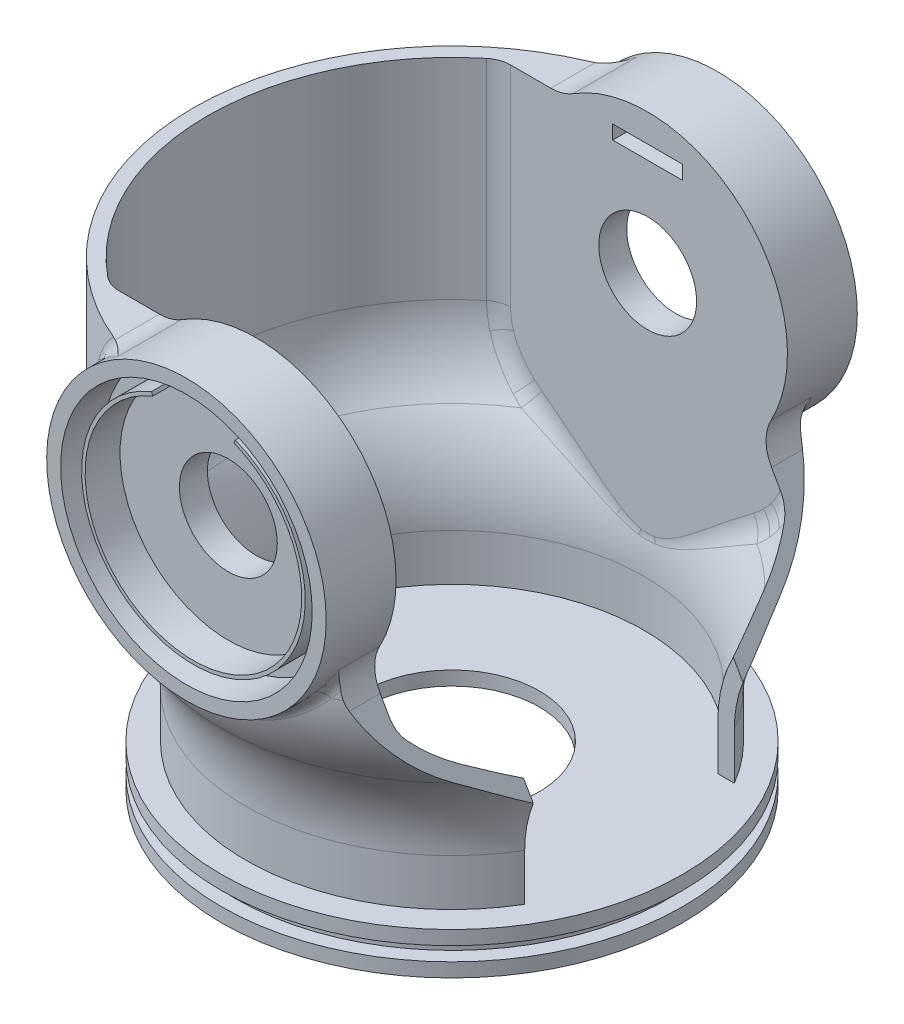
SolidWorks part; units mm, degrees
ref_plane "Front Plane" through (0, 0, 0) normal (0, 0, 1) x (1, 0, 0)
ref_plane "Top Plane" through (0, 0, 0) normal (0, 1, 0) x (1, 0, 0)
ref_plane "Right Plane" through (0, 0, 0) normal (1, 0, 0) x (0, 0, -1)
sketch "Sketch1" plane through (0, 0, 0) normal (0, 0, 1) x (1, 0, 0)
  line L0 (0, 0) -> (14.75, 0)
  line L1 (14.75, 0) -> (14.75, 4.3408)
  line L2 (18.5, 16) -> (18.5, 31)
  line L3 (0, 0) -> (0, 31) construction
  line L4 (0, 31) -> (18.5, 31)
  line L5 (0, 0) -> (0, 31)
  arc A0 (14.75, 4.3408) -> (16.625, 10.1704) centre (24.75, 4.3408) cw
  arc A1 (16.625, 10.1704) -> (18.5, 16) centre (8.5, 16) ccw
  dimension "D4" = 10
  dimension "D1" = 29.5
  dimension "D2" = 37
  dimension "D3" = 31
  dimension "D5" = 15
revolve "Revolve1" add sketch "Sketch1" angle 180 about L3
sketch "Sketch5" plane through (0, 0, 0) normal (0, 0, 1) x (1, 0, 0)
  line L0 (14.7718, 5) -> (0, 31)
  line L2 (18.5, 31) -> (-18.5, 31) construction
  line L4 (-14.75, 0) -> (14.75, 0) construction
  arc A1 (16.625, 10.1704) -> (14.75, 4.3408) centre (24.75, 4.3408) ccw construction
  dimension "D1" = 5
extrude "Cut-Extrude1" cut sketch "Sketch5" against normal through all and the other way through all flip side to cut
shell "Shell3" thickness 1
ref_plane "Plane3" through (0, 0, 14) normal (0, 0, 1) x (1, 0, 0)
sketch "Sketch12" plane through (0, 0, 14) normal (0, 0, 1) x (1, 0, 0)
  line L0 (50, 0) -> (-50, 0) construction
  line L1 (0, -19.25) -> (0, 19.25) construction
  circle A0 centre (0, 23) radius 10
  dimension "D1" = 20
  dimension "D2" = 33
extrude "Extrude3" add sketch "Sketch12" along normal blind 5
sketch "Sketch13" plane through (0, 0, 14) normal (0, 0, 1) x (1, 0, 0)
  line L0 (-10.5, 16) -> (-10.5, 31)
  line L1 (-10.5, 16) -> (-10.5, 31)
  line L2 (11.503, 10.7533) -> (8.5222, 16) construction
  line L3 (8.5222, 16) -> (7.9738, 16.9652) construction
  line L4 (9.919, 13.5414) -> (8.5222, 16)
  line L5 (8.5222, 16) -> (0, 31)
  line L6 (-6, 31) -> (-17.5, 31) construction
  line L7 (0, 31) -> (-10.5, 31)
  spline S0 degree 3 poles (-1610.744, 1184.5582) (-96.715, 147.1663) (24.7357, 34.5336) (9.246, 12.4544) (9.0415, 12.2045) (-14.2558, -12.5969) (-184.9404, 149.683) (1168.0357, -1616.7433) knots -20.598719 -20.598719 -20.598719 -20.598719 0.25 0.25 0.5 0.5 26.706636 26.706636 26.706636 26.706636 only from (9.919, 13.5414) to (7.3509, 10.7533)
  spline S1 degree 3 poles (9.919, 13.5414) (9.7769, 13.2523) (9.6131, 12.9776) (9.246, 12.4544) (9.0415, 12.2045) (8.381, 11.5014) (7.887, 11.1007) (7.3509, 10.7533) knots 0 0 0 0 0.25 0.25 0.5 0.5 1 1 1 1
  spline S2 degree 3 poles (-1247.715, -1556.5616) (227.3789, 167.0399) (17.8849, -14.0712) (-8.9779, 12.113) (-9.3228, 12.5315) (-9.7469, 13.2052) (-9.8737, 13.4381) (-10.096, 13.9219) (-10.1919, 14.1748) (-19.9885, 46.8844) (270.5798, 128.8134) (1943.6429, 438.5192) knots -17.177617 -17.177617 -17.177617 -17.177617 0.25 0.25 0.5 0.5 0.625 0.625 0.75 0.75 16.634825 16.634825 16.634825 16.634825 only from (-7.3509, 10.7533) to (-10.5, 16)
  spline S3 degree 3 poles (-7.3509, 10.7533) (-7.8006, 11.0447) (-8.2181, 11.3724) (-8.9779, 12.113) (-9.3228, 12.5315) (-9.7469, 13.2052) (-9.8737, 13.4381) (-10.096, 13.9219) (-10.1919, 14.1748) (-10.4214, 14.941) (-10.5, 15.464) (-10.5, 16) knots 0 0 0 0 0.25 0.25 0.5 0.5 0.625 0.625 0.75 0.75 1 1 1 1
  spline S4 degree 3 poles (982.7721, -1733.5918) (86.542, 44.2576) (40.6956, 33.6427) (4.9991, 9.1692) (4.4176, 8.7637) (3.5342, 8.1715) (3.2379, 7.9771) (2.6368, 7.6033) (2.3322, 7.4237) (1.7037, 7.0981) (1.3767, 6.9505) (0.8704, 6.7901) (0.699, 6.747) (0.3494, 6.6878) (0.1696, 6.6722) (-0.1851, 6.6731) (-0.361, 6.6892) (-0.6229, 6.7344) (-0.7099, 6.753) (-0.8833, 6.7964) (-0.9727, 6.8221) (-1.4026, 6.9605) (-1.7248, 7.1081) (-2.351, 7.4345) (-2.6545, 7.6139) (-3.2531, 7.9869) (-3.5481, 8.1808) (-4.428, 8.771) (-5.0082, 9.1754) (-40.8425, 33.7408) (-84.4372, 42.4109) (-1003.9598, -1721.6203) knots -7.380993 -7.380993 -7.380993 -7.380993 0.125 0.125 0.25 0.25 0.3125 0.3125 0.375 0.375 0.4375 0.4375 0.46875 0.46875 0.5 0.5 0.53125 0.53125 0.546875 0.546875 0.5625 0.5625 0.625 0.625 0.6875 0.6875 0.75 0.75 0.875 0.875 8.433454 8.433454 8.433454 8.433454 only from (7.3509, 10.7533) to (-7.3509, 10.7533)
  spline S5 degree 3 poles (7.3509, 10.7533) (6.7563, 10.3681) (6.1686, 9.971) (4.9991, 9.1692) (4.4176, 8.7637) (3.5342, 8.1715) (3.2379, 7.9771) (2.6368, 7.6033) (2.3322, 7.4237) (1.7037, 7.0981) (1.3767, 6.9505) (0.8704, 6.7901) (0.699, 6.747) (0.3494, 6.6878) (0.1696, 6.6722) (-0.1851, 6.6731) (-0.361, 6.6892) (-0.6229, 6.7344) (-0.7099, 6.753) (-0.8833, 6.7964) (-0.9727, 6.8221) (-1.4026, 6.9605) (-1.7248, 7.1081) (-2.351, 7.4345) (-2.6545, 7.6139) (-3.2531, 7.9869) (-3.5481, 8.1808) (-4.428, 8.771) (-5.0082, 9.1754) (-6.1741, 9.9747) (-6.7594, 10.3701) (-7.3509, 10.7533) knots 0 0 0 0 0.125 0.125 0.25 0.25 0.3125 0.3125 0.375 0.375 0.4375 0.4375 0.46875 0.46875 0.5 0.5 0.53125 0.53125 0.546875 0.546875 0.5625 0.5625 0.625 0.625 0.6875 0.6875 0.75 0.75 0.875 0.875 1 1 1 1
extrude "Extrude5" add sketch "Sketch13" along normal up to body separate body
sketch "Sketch11" plane through (0, 1, 0) normal (0, 1, 0) x (-1, 0, 0)
  circle A0 centre (0, 0) radius 6.25
  dimension "D1" = 12.5
extrude "Cut-Extrude3" cut sketch "Sketch11" against normal through all
fillet "Fillet4" radius 2 13 edges
fillet "Fillet9" radius 3 1 edges at (-6, 31, 15.75)
fillet "Fillet11" radius 3 4 edges at (8.2491, 16.4806, 16.5591) (7.9738, 16.9652, 15.3467) (8.5222, 16, 14.6424) (8.248, 16.4826, 14)
fillet "Fillet12" radius 1 3 edges at (-9.7817, 25.078, 15.7025) (-1.6049, 13.1296, 18.0078)
sketch "Sketch16" plane through (0, 0, 0) normal (0, 0, -1) x (-1, 0, 0)
  line L0 (-16.5, -1) -> (-16.5, -2)
  line L1 (-14.75, 1) -> (-16.5, 1)
  line L2 (-14.75, 1) -> (-14.75, -2)
  line L3 (-14.75, -2) -> (-16.5, -2)
  line L4 (-16.5, 1) -> (-16.5, 0)
  line L5 (-16.5, 0) -> (-15.5, 0)
  line L6 (0, 0) -> (0, 6.5274) construction
  line L7 (-16.5, -1) -> (-15.5, -1)
  line L8 (-15.5, 0) -> (-15.5, -1)
  line L10 (-14.75, 0) -> (-14.75, 4.3408) construction
  line L11 (-14.75, 0) -> (-6.25, 0) construction
  dimension "D1" = 33
  dimension "D2" = 3
  dimension "D3" = 1
revolve "Revolve2" add sketch "Sketch16" angle 180 about L6
sketch "Sketch18" plane through (0, 0, 19) normal (0, 0, 1) x (1, 0, 0)
  circle A2 centre (0, 23) radius 9
  circle A3 centre (0, 23) radius 9
  dimension "D1" = 1
extrude "Cut-Extrude5" cut sketch "Sketch18" against normal blind 3
sketch "Sketch19" plane through (0, 0, 16) normal (0, 0, 1) x (1, 0, 0)
  line L0 (0, 23) -> (0, 30) construction
  line L1 (-2.5, 31) -> (2.5, 31)
  line L2 (-2.5, 31) -> (-2.5, 30)
  line L3 (-2.5, 30) -> (2.5, 30)
  line L4 (2.5, 31) -> (2.5, 30)
  circle A2 centre (0, 23) radius 10 construction
  dimension "D1" = 1
  dimension "D2" = 5
  dimension "D3" = 2
extrude "Cut-Extrude6" cut sketch "Sketch19" against normal through all
sketch "Sketch20" plane through (0, 0, 16) normal (0, 0, 1) x (1, 0, 0)
  line L0 (2.5, 30) -> (2.5, 31) construction
  line L1 (-2.5, 31) -> (-2.5, 30) construction
  arc A0 (3, 30.4162) -> (-3, 30.4162) centre (0, 23) cw
  dimension "D3" = 8
  dimension "D1" = 0.5
  dimension "D2" = 0.5
extrude "Extrude-Thin1" add sketch "Sketch20" along normal offset from surface (2.5 mm away) 0.5 thin
hole_wizard "M7.0 (7) Diameter Hole1" positions "Sketch22" profile "Sketch21" hole size "M7.0" standard "Ansi Metric"
sketch "Sketch22" plane through (0, 0, 16) normal (0, 0, 1) x (1, 0, 0)
  point P0 (0, 23)
sketch "Sketch21" plane through (0, 23, 16) normal (1, 0, 0) x (0, -1, 0)
  line L0 (0, 0) -> (0, 16)
  line L1 (0, 16) -> (3.5, 16)
  line L2 (3.5, 16) -> (3.5, 0)
  line L5 (3.5, 0) -> (0, 0)
  line L11 (0, -6.35) -> (0, 107.95) construction
  dimension "Thru Hole Dia." = 7
  dimension "Thru Hole Depth" = 16
sketch "Sketch6" plane through (0, 1, 0) normal (0, 1, 0) x (-1, 0, 0)
  line L0 (0, 0) -> (-14.7718, 0) construction
  line L1 (-14.7718, 7.5) -> (-14.7718, -7.5)
  line L2 (-14.7718, -7.5) -> (0, -7.5)
  line L3 (-14.7718, 7.5) -> (0, 7.5)
  line L4 (0, -7.5) -> (0, 7.5)
  spline S0 degree 3 poles (-11.8342, 11.6765) (-12.1539, 10.7778) (-12.481, 9.8888) (-13.1202, 8.0912) (-13.4328, 7.1834) (-13.8611, 5.769) (-13.997, 5.2887) (-14.1847, 4.5473) (-14.2446, 4.2966) (-14.3576, 3.7867) (-14.411, 3.5262) (-14.6538, 2.214) (-14.7718, 1.1319) (-14.7718, 0) knots 0 0 0 0 0.25 0.25 0.5 0.5 0.625 0.625 0.6875 0.6875 0.75 0.75 1 1 1 1 construction
  dimension "D1" = 15
extrude "Cut-Extrude2" cut sketch "Sketch6" along normal through all
mirror "Mirror2"
sketch "Sketch17" plane through (0, 1, 0) normal (0, 1, 0) x (-1, 0, 0)
  line L0 (0, 0) -> (0, 6.75) construction
  line L1 (-3, 6.75) -> (-3, 5.4829)
  line L2 (-3, 6.75) -> (3, 6.75)
  line L3 (3, 6.75) -> (3, 5.4829)
  circle A0 centre (0, 0) radius 6.25 construction
  dimension "D1" = 6
  dimension "D2" = 13
extrude "Cut-Extrude4" cut sketch "Sketch17" against normal through all and the other way through all flip side to cut
